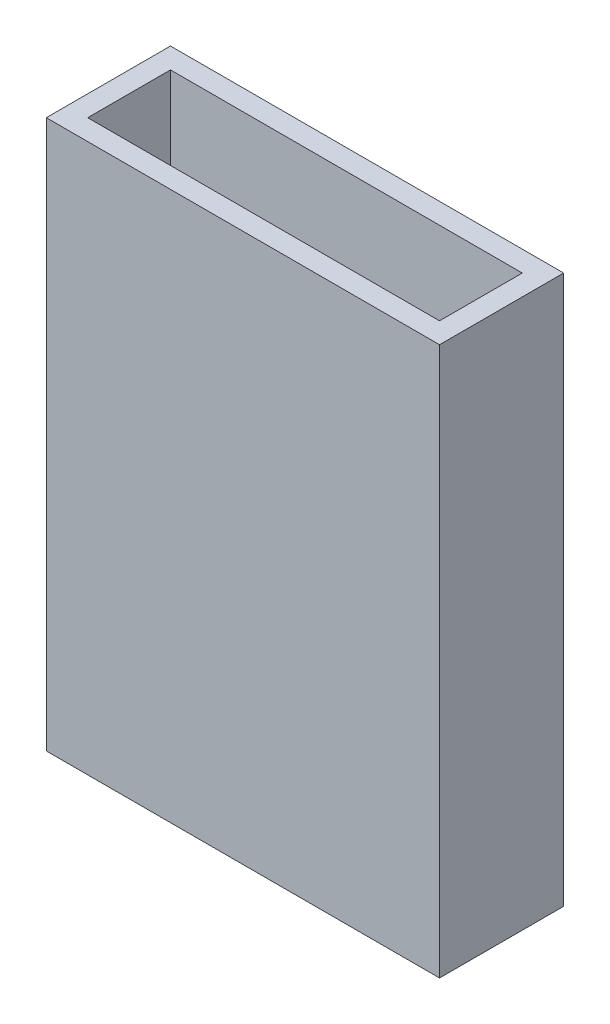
SolidWorks part; units mm, degrees
ref_plane "Alzado" through (0, 0, 0) normal (0, 0, 1) x (1, 0, 0)
ref_plane "Planta" through (0, 0, 0) normal (0, 1, 0) x (1, 0, 0)
ref_plane "Vista lateral" through (0, 0, 0) normal (1, 0, 0) x (0, 0, -1)
sketch "Croquis1" plane through (0, 0, 0) normal (0, 1, 0) x (1, 0, 0)
  line L1 (19, -6) -> (-19, -6)
  line L2 (19, -6) -> (19, 6)
  line L3 (19, 6) -> (-19, 6)
  line L4 (-19, -6) -> (-19, 6)
  line L5 (19, -6) -> (-19, 6) construction
  line L6 (19, 6) -> (-19, -6) construction
  point P0 (0, 0)
  dimension "D1" = 38
  dimension "D2" = 12
extrude "Saliente-Extruir1" add sketch "Croquis1" along normal blind 3
sketch "Croquis2" plane through (0, 3, 0) normal (0, 1, 0) x (1, 0, 0)
  line L0 (-17, 4) -> (-17, -4)
  line L1 (-17, -4) -> (17, -4)
  line L2 (17, -4) -> (17, 4)
  line L3 (17, 4) -> (-17, 4)
  line L4 (-19, 6) -> (-19, -6)
  line L5 (-19, -6) -> (19, -6)
  line L6 (19, -6) -> (19, 6)
  line L7 (19, 6) -> (-19, 6)
  line L8 (-19, 6) -> (-19, -6)
  line L9 (-19, -6) -> (19, -6)
  line L10 (19, -6) -> (19, 6)
  line L11 (19, 6) -> (-19, 6)
  dimension "D1" = 0
  dimension "D2" = 2
extrude "Saliente-Extruir2" add sketch "Croquis2" along normal blind 50
sketch "Croquis3" plane through (0, 3, 0) normal (0, 1, 0) x (1, 0, 0)
  line L0 (-17, 0) -> (17, 0) construction
  line L1 (-17, 4) -> (-17, -4) construction
  line L2 (17, -4) -> (17, 4) construction
  line L3 (0, 4) -> (0, -4) construction
  line L4 (17, 4) -> (-17, 4) construction
  line L5 (-17, -4) -> (17, -4) construction
  circle A0 centre (-12.5, 0) radius 1.5
  circle A1 centre (12.5, 0) radius 1.5
  dimension "D1" = 3
  dimension "D2" = 25
extrude "Cortar-Extruir1" cut sketch "Croquis3" against normal through all both and the other way through all
